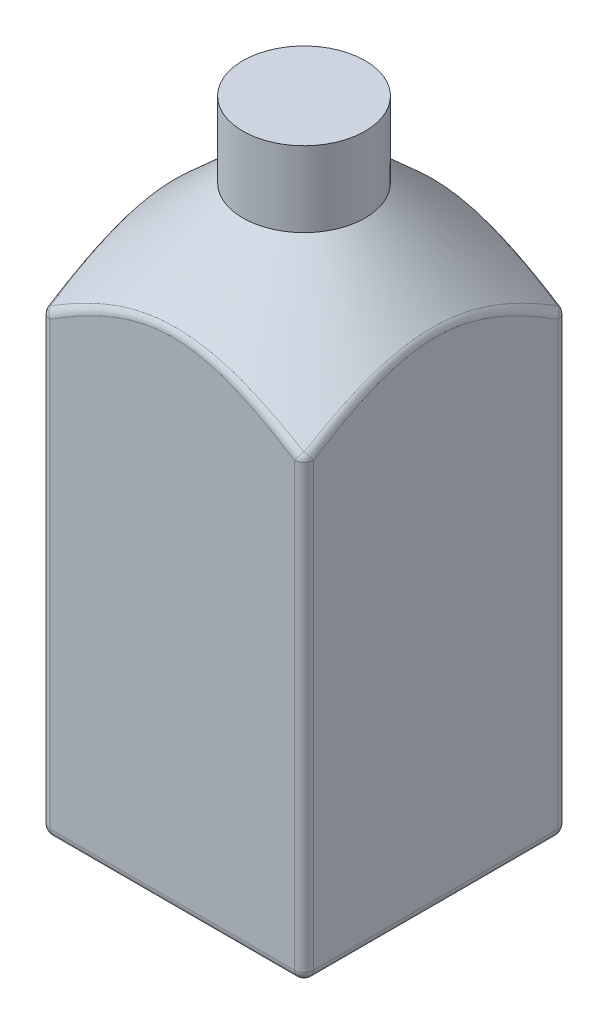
SolidWorks part; units mm, degrees
ref_plane "Front Plane" through (0, 0, 0) normal (0, 0, 1) x (1, 0, 0)
ref_plane "Top Plane" through (0, 0, 0) normal (0, 1, 0) x (1, 0, 0)
ref_plane "Right Plane" through (0, 0, 0) normal (1, 0, 0) x (0, 0, -1)
sketch "Sketch1" plane through (0, 0, 0) normal (0, 0, 1) x (1, 0, 0)
  line L0 (0, 0) -> (0, 295.5982) construction
  line L1 (0, 215.9) -> (-20.6375, 215.9)
  line L2 (-20.6375, 215.9) -> (-20.6375, 190.5)
  line L3 (-20.6375, 190.5) -> (-62.8523, 152.4)
  line L4 (-62.8523, 152.4) -> (-62.8523, 0)
  line L5 (-62.8523, 0) -> (0, 0)
  line L6 (0, 0) -> (0, 215.9)
  dimension "D1" = 125.7046
  dimension "D2" = 215.9
  dimension "D3" = 152.4
  dimension "D4" = 25.4
  dimension "D5" = 41.275
revolve "Revolve1" add sketch "Sketch1" angle 360 about L0
sketch "Sketch2" plane through (0, 0, 0) normal (0, -1, 0) x (1, 0, 0)
  line L1 (44.4433, 44.4433) -> (-44.4433, 44.4433)
  line L2 (-44.4433, 44.4433) -> (-44.4433, -44.4433)
  line L3 (-44.4433, -44.4433) -> (44.4433, -44.4433)
  line L4 (44.4433, -44.4433) -> (44.4433, 44.4433)
  circle A0 centre (0, 0) radius 44.4433 construction
  circle A1 centre (0, 0) radius 62.8523 construction
extrude "Cut-Extrude1" cut sketch "Sketch2" against normal through all flip side to cut
fillet "Fillet1" radius 3.175 12 edges at (0, 0, -44.4433) (-13.2099, 167.2803, -44.4433) (44.4433, 76.2, -44.4433) (44.4433, 0, 0) (44.4433, 167.2803, -13.2099) (44.4433, 76.2, 44.4433) (0, 0, 44.4433) (13.2099, 167.2803, 44.4433) (-44.4433, 76.2, 44.4433) (-44.4433, 0, 0) (-44.4433, 76.2, -44.4433) (-44.4433, 167.2803, 13.2099)
